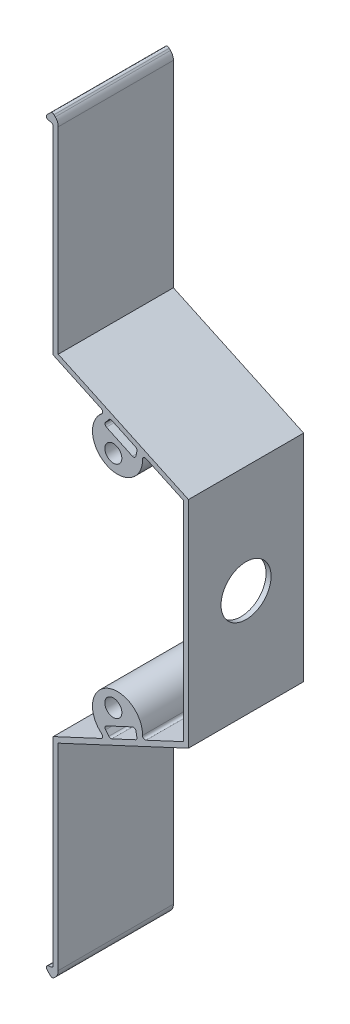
SolidWorks part; units mm, degrees
ref_plane "前视基准面" through (0, 0, 0) normal (0, 0, 1) x (1, 0, 0)
ref_plane "上视基准面" through (0, 0, 0) normal (0, 1, 0) x (1, 0, 0)
ref_plane "右视基准面" through (0, 0, 0) normal (1, 0, 0) x (0, 0, -1)
other "Configuration Table"
sketch "草图1" plane through (0, 0, 0) normal (0, 0, 1) x (1, 0, 0)
  line L2 (95, -72.9584) -> (95, -33.624) construction
  line L3 (95, -33.624) -> (121, -21.5) construction
  line L4 (95, -72.9584) -> (95, -33.624)
  line L5 (95, -33.624) -> (121, -21.5)
  line L7 (121, -21.5) -> (121, 21.5)
  line L8 (95, 33.624) -> (95, 72.9584) construction
  line L9 (95, 33.624) -> (95, 72.9584)
  line L10 (121, -21.5) -> (121, 21.5) construction
  line L11 (120, -20.8629) -> (120, 20.8629)
  line L12 (120, -20.8629) -> (112.5426, -24.3404)
  line L13 (121, 0) -> (102.4527, 0) construction
  line L14 (103.5873, -28.5163) -> (94, -32.9869)
  line L15 (94, -32.9869) -> (94, -72.5446)
  line L16 (93.5609, -73.0408) -> (93.0647, -73.1018)
  line L17 (74.3726, -94.4142) -> (94.4142, -74.3726) construction
  line L18 (94.4142, -74.3726) -> (94.1572, -74.6296)
  line L19 (93.4501, -74.6296) -> (92.772, -73.9516)
  line L20 (93.4501, 74.6296) -> (92.772, 73.9516)
  line L21 (94.4142, 74.3726) -> (94.1572, 74.6296)
  line L22 (93.5609, 73.0408) -> (93.0647, 73.1018)
  line L23 (94, 32.9869) -> (94, 72.5446)
  line L24 (103.5873, 28.5163) -> (94, 32.9869)
  line L25 (120, 20.8629) -> (112.5426, 24.3404)
  line L26 (95, 33.624) -> (121, 21.5)
  line L27 (95, 72.9584) -> (95, 33.624)
  arc A0 (111.8314, -23.8779) -> (103.6902, -27.6742) centre (106.8323, -23.7848) ccw
  arc A1 (94.4142, -74.3726) -> (95, -72.9584) centre (93, -72.9584) ccw construction
  arc A2 (94.4142, -74.3726) -> (95, -72.9584) centre (93, -72.9584) ccw
  arc A3 (94, -72.5446) -> (93.5609, -73.0408) centre (93.5, -72.5446) cw
  arc A4 (94.1572, -74.6296) -> (93.4501, -74.6296) centre (93.8036, -74.2761) cw
  arc A5 (93.0647, -73.1018) -> (92.772, -73.9516) centre (93.1256, -73.598) ccw
  arc A6 (93.0647, 73.1018) -> (92.772, 73.9516) centre (93.1256, 73.598) cw
  arc A7 (94.1572, 74.6296) -> (93.4501, 74.6296) centre (93.8036, 74.2761) ccw
  arc A8 (94, 72.5446) -> (93.5609, 73.0408) centre (93.5, 72.5446) ccw
  arc A9 (94.4142, 74.3726) -> (95, 72.9584) centre (93, 72.9584) cw
  arc A10 (111.8314, 23.8779) -> (103.6902, 27.6742) centre (106.8323, 23.7848) cw
  circle A15 centre (106, 22) radius 1.7
  circle A16 centre (106, -22) radius 1.7
  arc A17 (103.6902, -27.6742) -> (103.5873, -28.5163) centre (103.376, -28.0631) cw
  arc A18 (112.5426, -24.3404) -> (111.8314, -23.8779) centre (112.3313, -23.8872) cw
  arc A19 (111.8314, 23.8779) -> (112.5426, 24.3404) centre (112.3313, 23.8872) cw
  arc A20 (103.6902, 27.6742) -> (103.5873, 28.5163) centre (103.376, 28.0631) ccw
  point P27 (94, -72.9869)
  point P30 (93.8036, -74.9832)
  point P50 (120, 0)
  point P51 (121, 0)
  point P53 (93.8036, 74.9832)
  point P54 (94, 72.9869)
  point P60 (104.3844, -28.1446)
  point P65 (111.7455, -24.7121)
  point P68 (111.7455, 24.7121)
  point P71 (104.3844, 28.1446)
  dimension "D4" = 5
  dimension "D8" = 0.5
  dimension "D9" = 0.5
  dimension "D11" = 3.4
  dimension "D12" = 3.4
  dimension "D13" = 0.5
  dimension "D1" = 1
  dimension "D2" = 1
  dimension "D3" = 1
  dimension "D5" = 11.4579
  dimension "D6" = 9.1078
  dimension "D7" = 40
  dimension "D10" = 97
extrude "凸台-拉伸1" add sketch "草图1" along normal up to surface (23 mm away) contours L13 L7 L26 L9 A9 L21 A7 L20 A6 L22 A8 L23 L24 A20 A10 A19 L25 L11 A15 | L7 L13 L11 L12 A18 A0 A17 L14 L15 A3 L16 A5 L19 A4 L18 A2 L4 L5 A16
sketch "草图2" plane through (0, 0, 23) normal (0, 0, 1) x (1, 0, 0)
  line L0 (95, 33.624) -> (121, 21.5) construction
  line L1 (105.346, 27.6962) -> (110.7839, 25.1605)
  line L2 (105.346, 27.6962) -> (104.0476, 26.0949)
  line L3 (104.0476, 26.0949) -> (110.3918, 23.1365)
  line L4 (110.7839, 25.1605) -> (110.3918, 23.1365)
  line L5 (106, 22) -> (108.4876, 27.3346) construction
  point P6 (108.065, 26.4283)
  point P10 (107.2197, 24.6157)
  dimension "D1" = 1
  dimension "D2" = 2
  dimension "D3" = 7
  dimension "D4" = 6
extrude "切除-拉伸1" cut sketch "草图2" against normal up to surface (23 mm away)
fillet "圆角1" radius 0.5 4 edges at (104.0476, 26.0949, 11.5) (105.346, 27.6962, 11.5) (110.7839, 25.1605, 11.5) (110.3918, 23.1365, 11.5)
mirror "镜向1" about plane through (0, 0, 0) normal (0, 1, 0) of "圆角1", "切除-拉伸1"
sketch "草图3" plane through (121, 0, 0) normal (1, 0, 0) x (0, 0, -1)
  line L0 (0, 0) -> (-23, 0) construction
  line L1 (-23, -21.5) -> (-23, 21.5) construction
  circle A0 centre (-11.5, 0) radius 5
  dimension "D1" = 10
extrude "切除-拉伸2" cut sketch "草图3" against normal blind 10
sketch "草图4" plane through (94, 0, 0) normal (-1, 0, 0) x (0, 0, 1)
  line L0 (0, -32.9869) -> (0, -72.5446) construction
  line L1 (0, -54.6296) -> (23, -54.6296)
  line L2 (0, -54.6296) -> (0, -64.6296)
  line L3 (0, -64.6296) -> (23, -64.6296)
  line L4 (23, -54.6296) -> (23, -64.6296)
  line L5 (23, -32.9869) -> (23, -72.5446) construction
  line L6 (23, -74.6296) -> (0, -74.6296) construction
  dimension "D1" = 10
  dimension "D2" = 10
